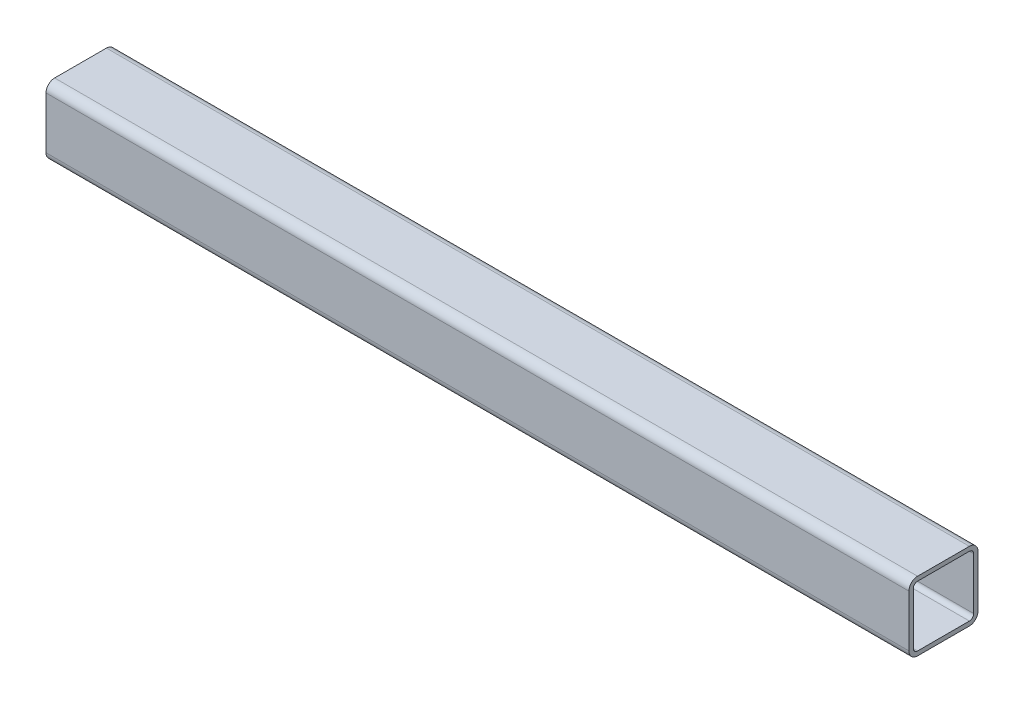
SolidWorks part; units mm, degrees
ref_plane "Front Plane" through (0, 0, 0) normal (0, 0, 1) x (1, 0, 0)
ref_plane "Top Plane" through (0, 0, 0) normal (0, 1, 0) x (1, 0, 0)
ref_plane "Right Plane" through (0, 0, 0) normal (1, 0, 0) x (0, 0, -1)
sketch "Sketch1" plane through (0, 0, 0) normal (0, 0, 1) x (1, 0, 0)
  line L1 (-635, 0) -> (635, 0)
  dimension "D1" = 1270
  dimension "D2" = 635
other "Structural Member1"
ref_plane "Plane1" through (0, 0, 0) normal (1, 0, 0) x (0, 1, 0)
sketch "Sketch11" plane through (-635, 0, 0) normal (1, 0, 0) x (0, 1, 0)
  line L0 (-38.1, -44.45) -> (38.1, -44.45)
  line L1 (-44.45, -38.1) -> (-44.45, 38.1)
  line L2 (38.1, 44.45) -> (-38.1, 44.45)
  line L3 (44.45, 38.1) -> (44.45, -38.1)
  line L4 (-38.1, -50.8) -> (38.1, -50.8)
  line L5 (-50.8, -38.1) -> (-50.8, 38.1)
  line L6 (38.1, 50.8) -> (-38.1, 50.8)
  line L7 (50.8, 38.1) -> (50.8, -38.1)
  line L8 (0, 0) -> (44.45, 0) construction
  line L9 (0, 0) -> (0, 44.45) construction
  arc A0 (50.8, 38.1) -> (38.1, 50.8) centre (38.1, 38.1) ccw
  arc A1 (38.1, -50.8) -> (50.8, -38.1) centre (38.1, -38.1) ccw
  arc A2 (-50.8, -38.1) -> (-38.1, -50.8) centre (-38.1, -38.1) ccw
  arc A3 (-38.1, 50.8) -> (-50.8, 38.1) centre (-38.1, 38.1) ccw
  arc A4 (-38.1, 44.45) -> (-44.45, 38.1) centre (-38.1, 38.1) ccw
  arc A5 (44.45, 38.1) -> (38.1, 44.45) centre (38.1, 38.1) ccw
  arc A6 (38.1, -44.45) -> (44.45, -38.1) centre (38.1, -38.1) ccw
  arc A7 (-44.45, -38.1) -> (-38.1, -44.45) centre (-38.1, -38.1) ccw
  point P3 (0, 50.8)
  point P4 (50.8, 0)
  point P5 (0, -50.8)
  point P6 (-50.8, 0)
  point P7 (-50.8, 50.8)
  point P8 (-50.8, -50.8)
  point P33 (0, 0)
  point P35 (50.8, -50.8)
  point P36 (50.8, 50.8)
  point P37 (0, 0)
  dimension "D1" = 12.7
  dimension "Thickness" = 6.35
  dimension "V_leg" = 101.6
